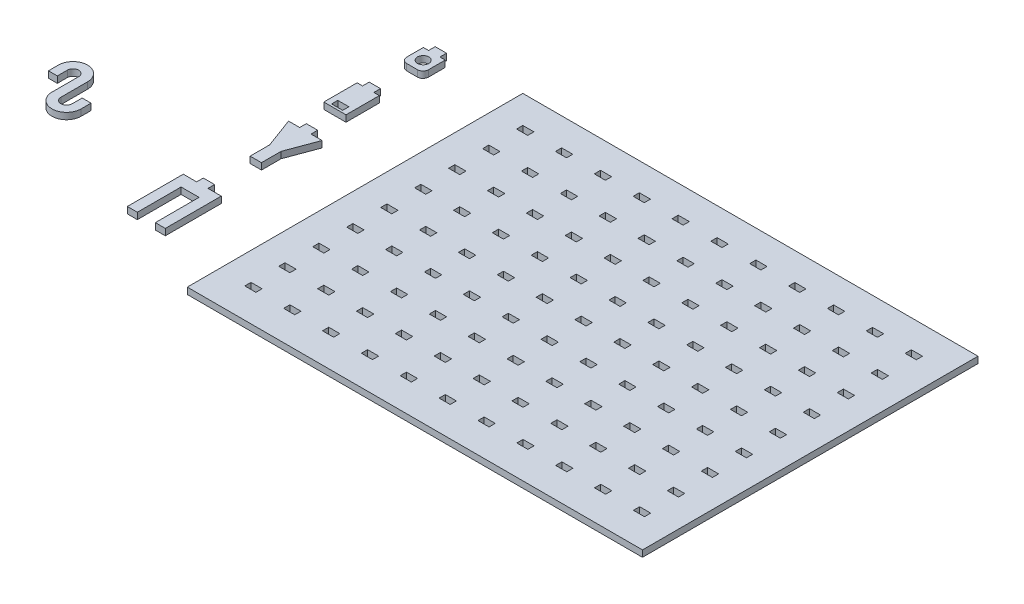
SolidWorks part; units mm, degrees
ref_plane "Front Plane" through (0, 0, 0) normal (0, 0, 1) x (1, 0, 0)
ref_plane "Top Plane" through (0, 0, 0) normal (0, 1, 0) x (1, 0, 0)
ref_plane "Right Plane" through (0, 0, 0) normal (1, 0, 0) x (0, 0, -1)
sketch "Sketch1" plane through (0, 0, 0) normal (0, 1, 0) x (1, 0, 0)
  line L0 (-140, 122.4146) -> (-130, 122.4146)
  line L1 (-200, -154.7854) -> (210, -154.7854)
  line L2 (-200, -154.7854) -> (-200, 147.4146)
  line L3 (-200, 147.4146) -> (210, 147.4146)
  line L4 (210, -154.7854) -> (210, 147.4146)
  line L5 (-175, 116.8146) -> (-165, 116.8146)
  line L6 (-200, 147.4146) -> (210, -154.7854) construction
  line L7 (-175, 116.8146) -> (-175, 122.4146)
  line L8 (-175, 122.4146) -> (-165, 122.4146)
  line L9 (-165, 116.8146) -> (-165, 122.4146)
  line L10 (-175, 116.8146) -> (-165, 122.4146) construction
  line L11 (-175, 122.4146) -> (-165, 116.8146) construction
  line L12 (-140, 116.8146) -> (-140, 122.4146)
  line L13 (-140, 116.8146) -> (-130, 116.8146)
  line L14 (-130, 116.8146) -> (-130, 122.4146)
  line L15 (-105, 122.4146) -> (-95, 122.4146)
  line L16 (-105, 116.8146) -> (-105, 122.4146)
  line L17 (-105, 116.8146) -> (-95, 116.8146)
  line L18 (-95, 116.8146) -> (-95, 122.4146)
  line L19 (-70, 122.4146) -> (-60, 122.4146)
  line L20 (-70, 116.8146) -> (-70, 122.4146)
  line L21 (-70, 116.8146) -> (-60, 116.8146)
  line L22 (-60, 116.8146) -> (-60, 122.4146)
  line L23 (-35, 122.4146) -> (-25, 122.4146)
  line L24 (-35, 116.8146) -> (-35, 122.4146)
  line L25 (-35, 116.8146) -> (-25, 116.8146)
  line L26 (-25, 116.8146) -> (-25, 122.4146)
  line L27 (0, 122.4146) -> (10, 122.4146)
  line L28 (0, 116.8146) -> (0, 122.4146)
  line L29 (0, 116.8146) -> (10, 116.8146)
  line L30 (10, 116.8146) -> (10, 122.4146)
  line L31 (35, 122.4146) -> (45, 122.4146)
  line L32 (35, 116.8146) -> (35, 122.4146)
  line L33 (35, 116.8146) -> (45, 116.8146)
  line L34 (45, 116.8146) -> (45, 122.4146)
  line L35 (70, 122.4146) -> (80, 122.4146)
  line L36 (70, 116.8146) -> (70, 122.4146)
  line L37 (70, 116.8146) -> (80, 116.8146)
  line L38 (80, 116.8146) -> (80, 122.4146)
  line L39 (105, 122.4146) -> (115, 122.4146)
  line L40 (105, 116.8146) -> (105, 122.4146)
  line L41 (105, 116.8146) -> (115, 116.8146)
  line L42 (115, 116.8146) -> (115, 122.4146)
  line L43 (140, 122.4146) -> (150, 122.4146)
  line L44 (140, 116.8146) -> (140, 122.4146)
  line L45 (140, 116.8146) -> (150, 116.8146)
  line L46 (150, 116.8146) -> (150, 122.4146)
  line L47 (175, 122.4146) -> (185, 122.4146)
  line L48 (175, 116.8146) -> (175, 122.4146)
  line L49 (175, 116.8146) -> (185, 116.8146)
  line L50 (185, 116.8146) -> (185, 122.4146)
  line L51 (-270.7628, 160.64) -> (-270.7628, 120.2756) construction
  line L52 (-275.8888, 144.3945) -> (-265.6888, 144.3945)
  line L53 (-275.8888, 144.3945) -> (-275.8888, 138.4445)
  line L54 (-272.877, 95.0581) -> (-272.877, 60.3266) construction
  line L55 (-265.6888, 144.3945) -> (-265.6888, 138.4445)
  line L56 (-275.8888, 144.3945) -> (-265.6888, 138.4445) construction
  line L57 (-270.7628, 141.4043) -> (-265.6888, 144.3945) construction
  line L58 (-275.8888, 138.4445) -> (-280.5889, 138.4445)
  line L59 (-265.9367, 118.4445) -> (-275.5889, 118.4445)
  line L60 (-260.9367, 123.4445) -> (-260.9367, 138.4445)
  line L61 (-260.9367, 138.4445) -> (-265.6888, 138.4445)
  line L62 (-280.5889, 123.4445) -> (-280.5889, 138.4445)
  line L63 (-260.9367, 118.4445) -> (-280.5889, 138.4445) construction
  line L64 (-260.9367, 138.4445) -> (-280.5889, 118.4445) construction
  line L65 (-277.977, 87.0583) -> (-267.777, 87.0583)
  line L66 (-277.977, 87.0583) -> (-277.977, 81.0583)
  line L67 (-140, 91.8146) -> (-130, 91.8146)
  line L68 (-140, 86.2146) -> (-140, 91.8146)
  line L69 (-140, 86.2146) -> (-130, 86.2146)
  line L70 (-130, 86.2146) -> (-130, 91.8146)
  line L71 (-105, 91.8146) -> (-95, 91.8146)
  line L72 (-105, 86.2146) -> (-105, 91.8146)
  line L73 (-105, 86.2146) -> (-95, 86.2146)
  line L74 (-95, 86.2146) -> (-95, 91.8146)
  line L75 (-70, 91.8146) -> (-60, 91.8146)
  line L76 (-70, 86.2146) -> (-70, 91.8146)
  line L77 (-70, 86.2146) -> (-60, 86.2146)
  line L78 (-60, 86.2146) -> (-60, 91.8146)
  line L79 (-35, 91.8146) -> (-25, 91.8146)
  line L80 (-35, 86.2146) -> (-35, 91.8146)
  line L81 (-35, 86.2146) -> (-25, 86.2146)
  line L82 (-25, 86.2146) -> (-25, 91.8146)
  line L83 (0, 91.8146) -> (10, 91.8146)
  line L84 (0, 86.2146) -> (0, 91.8146)
  line L85 (0, 86.2146) -> (10, 86.2146)
  line L86 (10, 86.2146) -> (10, 91.8146)
  line L87 (35, 91.8146) -> (45, 91.8146)
  line L88 (35, 86.2146) -> (35, 91.8146)
  line L89 (35, 86.2146) -> (45, 86.2146)
  line L90 (45, 86.2146) -> (45, 91.8146)
  line L91 (70, 91.8146) -> (80, 91.8146)
  line L92 (70, 86.2146) -> (70, 91.8146)
  line L93 (70, 86.2146) -> (80, 86.2146)
  line L94 (80, 86.2146) -> (80, 91.8146)
  line L95 (105, 91.8146) -> (115, 91.8146)
  line L96 (105, 86.2146) -> (105, 91.8146)
  line L97 (105, 86.2146) -> (115, 86.2146)
  line L98 (115, 86.2146) -> (115, 91.8146)
  line L99 (140, 91.8146) -> (150, 91.8146)
  line L100 (140, 86.2146) -> (140, 91.8146)
  line L101 (140, 86.2146) -> (150, 86.2146)
  line L102 (150, 86.2146) -> (150, 91.8146)
  line L103 (175, 91.8146) -> (185, 91.8146)
  line L104 (175, 86.2146) -> (175, 91.8146)
  line L105 (175, 86.2146) -> (185, 86.2146)
  line L106 (185, 86.2146) -> (185, 91.8146)
  line L107 (-277.877, 58.6716) -> (-267.877, 58.6716)
  line L108 (-267.777, 87.0583) -> (-267.777, 81.0583)
  line L109 (-277.977, 87.0583) -> (-267.777, 81.0583) construction
  line L110 (-277.977, 81.0583) -> (-267.777, 87.0583) construction
  line L111 (-277.977, 81.0583) -> (-282.8724, 81.0583)
  line L112 (-262.8816, 51.0583) -> (-282.8724, 51.0583)
  line L113 (-262.8816, 51.0583) -> (-262.8816, 81.0583)
  line L114 (-262.8816, 81.0583) -> (-267.777, 81.0583)
  line L115 (-282.8724, 51.0583) -> (-282.8724, 81.0583)
  line L116 (-262.8816, 51.0583) -> (-282.8724, 81.0583) construction
  line L117 (-262.8816, 81.0583) -> (-282.8724, 51.0583) construction
  line L118 (-277.877, 53.0716) -> (-277.877, 58.6716)
  line L119 (-277.877, 53.0716) -> (-267.877, 53.0716)
  line L120 (-267.877, 53.0716) -> (-267.877, 58.6716)
  line L121 (-268.7486, -6.567) -> (-268.7486, 42.3773) construction
  line L122 (-272.777, -45.7127) -> (-272.777, -115.1406) construction
  line L123 (-140, 61.2146) -> (-130, 61.2146)
  line L124 (-140, 55.6146) -> (-140, 61.2146)
  line L125 (-140, 55.6146) -> (-130, 55.6146)
  line L126 (-130, 55.6146) -> (-130, 61.2146)
  line L127 (-105, 61.2146) -> (-95, 61.2146)
  line L128 (-105, 55.6146) -> (-105, 61.2146)
  line L129 (-105, 55.6146) -> (-95, 55.6146)
  line L130 (-95, 55.6146) -> (-95, 61.2146)
  line L131 (-70, 61.2146) -> (-60, 61.2146)
  line L132 (-70, 55.6146) -> (-70, 61.2146)
  line L133 (-70, 55.6146) -> (-60, 55.6146)
  line L134 (-60, 55.6146) -> (-60, 61.2146)
  line L135 (-35, 61.2146) -> (-25, 61.2146)
  line L136 (-35, 55.6146) -> (-35, 61.2146)
  line L137 (-35, 55.6146) -> (-25, 55.6146)
  line L138 (-25, 55.6146) -> (-25, 61.2146)
  line L139 (0, 61.2146) -> (10, 61.2146)
  line L140 (0, 55.6146) -> (0, 61.2146)
  line L141 (0, 55.6146) -> (10, 55.6146)
  line L142 (10, 55.6146) -> (10, 61.2146)
  line L143 (35, 61.2146) -> (45, 61.2146)
  line L144 (35, 55.6146) -> (35, 61.2146)
  line L145 (35, 55.6146) -> (45, 55.6146)
  line L146 (45, 55.6146) -> (45, 61.2146)
  line L147 (70, 61.2146) -> (80, 61.2146)
  line L148 (70, 55.6146) -> (70, 61.2146)
  line L149 (70, 55.6146) -> (80, 55.6146)
  line L150 (80, 55.6146) -> (80, 61.2146)
  line L151 (105, 61.2146) -> (115, 61.2146)
  line L152 (105, 55.6146) -> (105, 61.2146)
  line L153 (105, 55.6146) -> (115, 55.6146)
  line L154 (115, 55.6146) -> (115, 61.2146)
  line L155 (140, 61.2146) -> (150, 61.2146)
  line L156 (140, 55.6146) -> (140, 61.2146)
  line L157 (140, 55.6146) -> (150, 55.6146)
  line L158 (150, 55.6146) -> (150, 61.2146)
  line L159 (175, 61.2146) -> (185, 61.2146)
  line L160 (175, 55.6146) -> (175, 61.2146)
  line L161 (175, 55.6146) -> (185, 55.6146)
  line L162 (185, 55.6146) -> (185, 61.2146)
  line L163 (-263.6486, 20.3034) -> (-263.6486, 26.3034)
  line L164 (-263.6486, 26.3034) -> (-273.8486, 26.3034)
  line L165 (-273.8486, 20.3034) -> (-273.8486, 26.3034)
  line L166 (-263.6486, 20.3034) -> (-273.8486, 26.3034) construction
  line L167 (-263.6486, 26.3034) -> (-273.8486, 20.3034) construction
  line L168 (-273.8486, 20.3034) -> (-283.8775, 20.3034)
  line L169 (-283.8775, 20.3034) -> (-273.8486, -6.6879)
  line L170 (-273.8486, -6.6879) -> (-273.8486, -24.3222)
  line L171 (-273.8486, -24.3222) -> (-263.6486, -24.3222)
  line L172 (-263.6486, -24.3222) -> (-263.6486, -6.6879)
  line L173 (-263.6486, -6.6879) -> (-253.6197, 20.3034)
  line L174 (-253.6197, 20.3034) -> (-263.6486, 20.3034)
  line L175 (-418.1294, -17.3103) -> (-418.1294, -147.1066) construction
  line L176 (-267.677, -68.4979) -> (-267.677, -62.4979)
  line L177 (-267.677, -62.4979) -> (-277.877, -62.4979)
  line L178 (-277.877, -68.4979) -> (-277.877, -62.4979)
  line L179 (-140, 30.6146) -> (-130, 30.6146)
  line L180 (-140, 25.0146) -> (-140, 30.6146)
  line L181 (-140, 25.0146) -> (-130, 25.0146)
  line L182 (-130, 25.0146) -> (-130, 30.6146)
  line L183 (-105, 30.6146) -> (-95, 30.6146)
  line L184 (-105, 25.0146) -> (-105, 30.6146)
  line L185 (-105, 25.0146) -> (-95, 25.0146)
  line L186 (-95, 25.0146) -> (-95, 30.6146)
  line L187 (-70, 30.6146) -> (-60, 30.6146)
  line L188 (-70, 25.0146) -> (-70, 30.6146)
  line L189 (-70, 25.0146) -> (-60, 25.0146)
  line L190 (-60, 25.0146) -> (-60, 30.6146)
  line L191 (-35, 30.6146) -> (-25, 30.6146)
  line L192 (-35, 25.0146) -> (-35, 30.6146)
  line L193 (-35, 25.0146) -> (-25, 25.0146)
  line L194 (-25, 25.0146) -> (-25, 30.6146)
  line L195 (0, 30.6146) -> (10, 30.6146)
  line L196 (0, 25.0146) -> (0, 30.6146)
  line L197 (0, 25.0146) -> (10, 25.0146)
  line L198 (10, 25.0146) -> (10, 30.6146)
  line L199 (35, 30.6146) -> (45, 30.6146)
  line L200 (35, 25.0146) -> (35, 30.6146)
  line L201 (35, 25.0146) -> (45, 25.0146)
  line L202 (45, 25.0146) -> (45, 30.6146)
  line L203 (70, 30.6146) -> (80, 30.6146)
  line L204 (70, 25.0146) -> (70, 30.6146)
  line L205 (70, 25.0146) -> (80, 25.0146)
  line L206 (80, 25.0146) -> (80, 30.6146)
  line L207 (105, 30.6146) -> (115, 30.6146)
  line L208 (105, 25.0146) -> (105, 30.6146)
  line L209 (105, 25.0146) -> (115, 25.0146)
  line L210 (115, 25.0146) -> (115, 30.6146)
  line L211 (140, 30.6146) -> (150, 30.6146)
  line L212 (140, 25.0146) -> (140, 30.6146)
  line L213 (140, 25.0146) -> (150, 25.0146)
  line L214 (150, 25.0146) -> (150, 30.6146)
  line L215 (175, 30.6146) -> (185, 30.6146)
  line L216 (175, 25.0146) -> (175, 30.6146)
  line L217 (175, 25.0146) -> (185, 25.0146)
  line L218 (185, 25.0146) -> (185, 30.6146)
  line L219 (-267.677, -68.4979) -> (-277.877, -62.4979) construction
  line L220 (-267.677, -62.4979) -> (-277.877, -68.4979) construction
  line L221 (-277.877, -68.4979) -> (-289.877, -68.4979)
  line L222 (-289.877, -68.4979) -> (-289.877, -118.8935)
  line L223 (-289.877, -118.8935) -> (-280.877, -118.8935)
  line L224 (-280.877, -118.8935) -> (-280.877, -79.4979)
  line L225 (-280.877, -79.4979) -> (-264.677, -79.4979)
  line L226 (-255.677, -118.8935) -> (-264.677, -118.8935)
  line L227 (-264.677, -118.8935) -> (-264.677, -79.4979)
  line L228 (-255.677, -68.4979) -> (-255.677, -118.8935)
  line L229 (-267.677, -68.4979) -> (-255.677, -68.4979)
  line L231 (-413.0294, -39.6105) -> (-413.0294, -63.6105)
  line L233 (-405.0294, -39.6105) -> (-405.0294, -63.6105)
  line L234 (-413.0294, -39.6105) -> (-405.0294, -63.6105) construction
  line L235 (-140, 0.0146) -> (-130, 0.0146)
  line L236 (-140, -5.5854) -> (-140, 0.0146)
  line L237 (-140, -5.5854) -> (-130, -5.5854)
  line L238 (-130, -5.5854) -> (-130, 0.0146)
  line L239 (-105, 0.0146) -> (-95, 0.0146)
  line L240 (-105, -5.5854) -> (-105, 0.0146)
  line L241 (-105, -5.5854) -> (-95, -5.5854)
  line L242 (-95, -5.5854) -> (-95, 0.0146)
  line L243 (-70, 0.0146) -> (-60, 0.0146)
  line L244 (-70, -5.5854) -> (-70, 0.0146)
  line L245 (-70, -5.5854) -> (-60, -5.5854)
  line L246 (-60, -5.5854) -> (-60, 0.0146)
  line L247 (-35, 0.0146) -> (-25, 0.0146)
  line L248 (-35, -5.5854) -> (-35, 0.0146)
  line L249 (-35, -5.5854) -> (-25, -5.5854)
  line L250 (-25, -5.5854) -> (-25, 0.0146)
  line L251 (0, 0.0146) -> (10, 0.0146)
  line L252 (0, -5.5854) -> (0, 0.0146)
  line L253 (0, -5.5854) -> (10, -5.5854)
  line L254 (10, -5.5854) -> (10, 0.0146)
  line L255 (35, 0.0146) -> (45, 0.0146)
  line L256 (35, -5.5854) -> (35, 0.0146)
  line L257 (35, -5.5854) -> (45, -5.5854)
  line L258 (45, -5.5854) -> (45, 0.0146)
  line L259 (70, 0.0146) -> (80, 0.0146)
  line L260 (70, -5.5854) -> (70, 0.0146)
  line L261 (70, -5.5854) -> (80, -5.5854)
  line L262 (80, -5.5854) -> (80, 0.0146)
  line L263 (105, 0.0146) -> (115, 0.0146)
  line L264 (105, -5.5854) -> (105, 0.0146)
  line L265 (105, -5.5854) -> (115, -5.5854)
  line L266 (115, -5.5854) -> (115, 0.0146)
  line L267 (140, 0.0146) -> (150, 0.0146)
  line L268 (140, -5.5854) -> (140, 0.0146)
  line L269 (140, -5.5854) -> (150, -5.5854)
  line L270 (150, -5.5854) -> (150, 0.0146)
  line L271 (175, 0.0146) -> (185, 0.0146)
  line L272 (175, -5.5854) -> (175, 0.0146)
  line L273 (175, -5.5854) -> (185, -5.5854)
  line L274 (185, -5.5854) -> (185, 0.0146)
  line L275 (-413.0294, -63.6105) -> (-405.0294, -39.6105) construction
  line L277 (-409.0294, -51.6105) -> (-497.7476, -51.6105) construction
  line L278 (-423.2294, -48.6105) -> (-431.2294, -48.6105)
  line L279 (-423.2294, -48.6105) -> (-423.2294, -39.6105)
  line L281 (-431.2294, -48.6105) -> (-431.2294, -39.6105)
  line L282 (-423.2294, -48.6105) -> (-431.2294, -39.6105) construction
  line L283 (-427.2294, -44.1105) -> (-431.2294, -48.6105) construction
  line L284 (-409.0294, -67.5686) -> (-409.0294, -109.2605) construction
  line L287 (-394.8294, -63.6105) -> (-394.8294, -54.6105)
  line L288 (-386.8294, -63.6105) -> (-386.8294, -54.6105)
  line L289 (-394.8294, -54.6105) -> (-386.8294, -54.6105)
  line L291 (-140, -30.5854) -> (-130, -30.5854)
  line L292 (-140, -36.1854) -> (-140, -30.5854)
  line L293 (-140, -36.1854) -> (-130, -36.1854)
  line L294 (-130, -36.1854) -> (-130, -30.5854)
  line L295 (-105, -30.5854) -> (-95, -30.5854)
  line L296 (-105, -36.1854) -> (-105, -30.5854)
  line L297 (-105, -36.1854) -> (-95, -36.1854)
  line L298 (-95, -36.1854) -> (-95, -30.5854)
  line L299 (-70, -30.5854) -> (-60, -30.5854)
  line L300 (-70, -36.1854) -> (-70, -30.5854)
  line L301 (-70, -36.1854) -> (-60, -36.1854)
  line L302 (-60, -36.1854) -> (-60, -30.5854)
  line L303 (-35, -30.5854) -> (-25, -30.5854)
  line L304 (-35, -36.1854) -> (-35, -30.5854)
  line L305 (-35, -36.1854) -> (-25, -36.1854)
  line L306 (-25, -36.1854) -> (-25, -30.5854)
  line L307 (0, -30.5854) -> (10, -30.5854)
  line L308 (0, -36.1854) -> (0, -30.5854)
  line L309 (0, -36.1854) -> (10, -36.1854)
  line L310 (10, -36.1854) -> (10, -30.5854)
  line L311 (35, -30.5854) -> (45, -30.5854)
  line L312 (35, -36.1854) -> (35, -30.5854)
  line L313 (35, -36.1854) -> (45, -36.1854)
  line L314 (45, -36.1854) -> (45, -30.5854)
  line L315 (70, -30.5854) -> (80, -30.5854)
  line L316 (70, -36.1854) -> (70, -30.5854)
  line L317 (70, -36.1854) -> (80, -36.1854)
  line L318 (80, -36.1854) -> (80, -30.5854)
  line L319 (105, -30.5854) -> (115, -30.5854)
  line L320 (105, -36.1854) -> (105, -30.5854)
  line L321 (105, -36.1854) -> (115, -36.1854)
  line L322 (115, -36.1854) -> (115, -30.5854)
  line L323 (140, -30.5854) -> (150, -30.5854)
  line L324 (140, -36.1854) -> (140, -30.5854)
  line L325 (140, -36.1854) -> (150, -36.1854)
  line L326 (150, -36.1854) -> (150, -30.5854)
  line L327 (175, -30.5854) -> (185, -30.5854)
  line L328 (175, -36.1854) -> (175, -30.5854)
  line L329 (175, -36.1854) -> (185, -36.1854)
  line L330 (185, -36.1854) -> (185, -30.5854)
  line L347 (-140, -61.1854) -> (-130, -61.1854)
  line L348 (-140, -66.7854) -> (-140, -61.1854)
  line L349 (-140, -66.7854) -> (-130, -66.7854)
  line L350 (-130, -66.7854) -> (-130, -61.1854)
  line L351 (-105, -61.1854) -> (-95, -61.1854)
  line L352 (-105, -66.7854) -> (-105, -61.1854)
  line L353 (-105, -66.7854) -> (-95, -66.7854)
  line L354 (-95, -66.7854) -> (-95, -61.1854)
  line L355 (-70, -61.1854) -> (-60, -61.1854)
  line L356 (-70, -66.7854) -> (-70, -61.1854)
  line L357 (-70, -66.7854) -> (-60, -66.7854)
  line L358 (-60, -66.7854) -> (-60, -61.1854)
  line L359 (-35, -61.1854) -> (-25, -61.1854)
  line L360 (-35, -66.7854) -> (-35, -61.1854)
  line L361 (-35, -66.7854) -> (-25, -66.7854)
  line L362 (-25, -66.7854) -> (-25, -61.1854)
  line L363 (0, -61.1854) -> (10, -61.1854)
  line L364 (0, -66.7854) -> (0, -61.1854)
  line L365 (0, -66.7854) -> (10, -66.7854)
  line L366 (10, -66.7854) -> (10, -61.1854)
  line L367 (35, -61.1854) -> (45, -61.1854)
  line L368 (35, -66.7854) -> (35, -61.1854)
  line L369 (35, -66.7854) -> (45, -66.7854)
  line L370 (45, -66.7854) -> (45, -61.1854)
  line L371 (70, -61.1854) -> (80, -61.1854)
  line L372 (70, -66.7854) -> (70, -61.1854)
  line L373 (70, -66.7854) -> (80, -66.7854)
  line L374 (80, -66.7854) -> (80, -61.1854)
  line L375 (105, -61.1854) -> (115, -61.1854)
  line L376 (105, -66.7854) -> (105, -61.1854)
  line L377 (105, -66.7854) -> (115, -66.7854)
  line L378 (115, -66.7854) -> (115, -61.1854)
  line L379 (140, -61.1854) -> (150, -61.1854)
  line L380 (140, -66.7854) -> (140, -61.1854)
  line L381 (140, -66.7854) -> (150, -66.7854)
  line L382 (150, -66.7854) -> (150, -61.1854)
  line L383 (175, -61.1854) -> (185, -61.1854)
  line L384 (175, -66.7854) -> (175, -61.1854)
  line L385 (175, -66.7854) -> (185, -66.7854)
  line L386 (185, -66.7854) -> (185, -61.1854)
  line L403 (-140, -91.7854) -> (-130, -91.7854)
  line L404 (-140, -97.3854) -> (-140, -91.7854)
  line L405 (-140, -97.3854) -> (-130, -97.3854)
  line L406 (-130, -97.3854) -> (-130, -91.7854)
  line L407 (-105, -91.7854) -> (-95, -91.7854)
  line L408 (-105, -97.3854) -> (-105, -91.7854)
  line L409 (-105, -97.3854) -> (-95, -97.3854)
  line L410 (-95, -97.3854) -> (-95, -91.7854)
  line L411 (-70, -91.7854) -> (-60, -91.7854)
  line L412 (-70, -97.3854) -> (-70, -91.7854)
  line L413 (-70, -97.3854) -> (-60, -97.3854)
  line L414 (-60, -97.3854) -> (-60, -91.7854)
  line L415 (-35, -91.7854) -> (-25, -91.7854)
  line L416 (-35, -97.3854) -> (-35, -91.7854)
  line L417 (-35, -97.3854) -> (-25, -97.3854)
  line L418 (-25, -97.3854) -> (-25, -91.7854)
  line L419 (0, -91.7854) -> (10, -91.7854)
  line L420 (0, -97.3854) -> (0, -91.7854)
  line L421 (0, -97.3854) -> (10, -97.3854)
  line L422 (10, -97.3854) -> (10, -91.7854)
  line L423 (35, -91.7854) -> (45, -91.7854)
  line L424 (35, -97.3854) -> (35, -91.7854)
  line L425 (35, -97.3854) -> (45, -97.3854)
  line L426 (45, -97.3854) -> (45, -91.7854)
  line L427 (70, -91.7854) -> (80, -91.7854)
  line L428 (70, -97.3854) -> (70, -91.7854)
  line L429 (70, -97.3854) -> (80, -97.3854)
  line L430 (80, -97.3854) -> (80, -91.7854)
  line L431 (105, -91.7854) -> (115, -91.7854)
  line L432 (105, -97.3854) -> (105, -91.7854)
  line L433 (105, -97.3854) -> (115, -97.3854)
  line L434 (115, -97.3854) -> (115, -91.7854)
  line L435 (140, -91.7854) -> (150, -91.7854)
  line L436 (140, -97.3854) -> (140, -91.7854)
  line L437 (140, -97.3854) -> (150, -97.3854)
  line L438 (150, -97.3854) -> (150, -91.7854)
  line L439 (175, -91.7854) -> (185, -91.7854)
  line L440 (175, -97.3854) -> (175, -91.7854)
  line L441 (175, -97.3854) -> (185, -97.3854)
  line L442 (185, -97.3854) -> (185, -91.7854)
  line L459 (-140, -122.3854) -> (-130, -122.3854)
  line L460 (-140, -127.9854) -> (-140, -122.3854)
  line L461 (-140, -127.9854) -> (-130, -127.9854)
  line L462 (-130, -127.9854) -> (-130, -122.3854)
  line L463 (-105, -122.3854) -> (-95, -122.3854)
  line L464 (-105, -127.9854) -> (-105, -122.3854)
  line L465 (-105, -127.9854) -> (-95, -127.9854)
  line L466 (-95, -127.9854) -> (-95, -122.3854)
  line L467 (-70, -122.3854) -> (-60, -122.3854)
  line L468 (-70, -127.9854) -> (-70, -122.3854)
  line L469 (-70, -127.9854) -> (-60, -127.9854)
  line L470 (-60, -127.9854) -> (-60, -122.3854)
  line L471 (-35, -122.3854) -> (-25, -122.3854)
  line L472 (-35, -127.9854) -> (-35, -122.3854)
  line L473 (-35, -127.9854) -> (-25, -127.9854)
  line L474 (-25, -127.9854) -> (-25, -122.3854)
  line L475 (0, -122.3854) -> (10, -122.3854)
  line L476 (0, -127.9854) -> (0, -122.3854)
  line L477 (0, -127.9854) -> (10, -127.9854)
  line L478 (10, -127.9854) -> (10, -122.3854)
  line L479 (35, -122.3854) -> (45, -122.3854)
  line L480 (35, -127.9854) -> (35, -122.3854)
  line L481 (35, -127.9854) -> (45, -127.9854)
  line L482 (45, -127.9854) -> (45, -122.3854)
  line L483 (70, -122.3854) -> (80, -122.3854)
  line L484 (70, -127.9854) -> (70, -122.3854)
  line L485 (70, -127.9854) -> (80, -127.9854)
  line L486 (80, -127.9854) -> (80, -122.3854)
  line L487 (105, -122.3854) -> (115, -122.3854)
  line L488 (105, -127.9854) -> (105, -122.3854)
  line L489 (105, -127.9854) -> (115, -127.9854)
  line L490 (115, -127.9854) -> (115, -122.3854)
  line L491 (140, -122.3854) -> (150, -122.3854)
  line L492 (140, -127.9854) -> (140, -122.3854)
  line L493 (140, -127.9854) -> (150, -127.9854)
  line L494 (150, -127.9854) -> (150, -122.3854)
  line L495 (175, -122.3854) -> (185, -122.3854)
  line L496 (175, -127.9854) -> (175, -122.3854)
  line L497 (175, -127.9854) -> (185, -127.9854)
  line L498 (185, -127.9854) -> (185, -122.3854)
  line L627 (-175, 91.8146) -> (-165, 91.8146)
  line L628 (-175, 86.2146) -> (-175, 91.8146)
  line L629 (-175, 86.2146) -> (-165, 86.2146)
  line L630 (-165, 86.2146) -> (-165, 91.8146)
  line L631 (-175, 61.2146) -> (-165, 61.2146)
  line L632 (-175, 55.6146) -> (-175, 61.2146)
  line L633 (-175, 55.6146) -> (-165, 55.6146)
  line L634 (-165, 55.6146) -> (-165, 61.2146)
  line L635 (-175, 30.6146) -> (-165, 30.6146)
  line L636 (-175, 25.0146) -> (-175, 30.6146)
  line L637 (-175, 25.0146) -> (-165, 25.0146)
  line L638 (-165, 25.0146) -> (-165, 30.6146)
  line L639 (-175, 0.0146) -> (-165, 0.0146)
  line L640 (-175, -5.5854) -> (-175, 0.0146)
  line L641 (-175, -5.5854) -> (-165, -5.5854)
  line L642 (-165, -5.5854) -> (-165, 0.0146)
  line L643 (-175, -30.5854) -> (-165, -30.5854)
  line L644 (-175, -36.1854) -> (-175, -30.5854)
  line L645 (-175, -36.1854) -> (-165, -36.1854)
  line L646 (-165, -36.1854) -> (-165, -30.5854)
  line L647 (-175, -61.1854) -> (-165, -61.1854)
  line L648 (-175, -66.7854) -> (-175, -61.1854)
  line L649 (-175, -66.7854) -> (-165, -66.7854)
  line L650 (-165, -66.7854) -> (-165, -61.1854)
  line L651 (-175, -91.7854) -> (-165, -91.7854)
  line L652 (-175, -97.3854) -> (-175, -91.7854)
  line L653 (-175, -97.3854) -> (-165, -97.3854)
  line L654 (-165, -97.3854) -> (-165, -91.7854)
  line L655 (-175, -122.3854) -> (-165, -122.3854)
  line L656 (-175, -127.9854) -> (-175, -122.3854)
  line L657 (-175, -127.9854) -> (-165, -127.9854)
  line L658 (-165, -127.9854) -> (-165, -122.3854)
  line L667 (210, 122.4146) -> (220, 122.4146)
  line L668 (210, 116.8146) -> (220, 116.8146)
  line L669 (220, 116.8146) -> (220, 122.4146)
  line L670 (245, 122.4146) -> (255, 122.4146)
  line L671 (245, 116.8146) -> (245, 122.4146)
  line L672 (245, 116.8146) -> (255, 116.8146)
  line L673 (255, 116.8146) -> (255, 122.4146)
  line L674 (280, 122.4146) -> (290, 122.4146)
  line L675 (280, 116.8146) -> (280, 122.4146)
  line L676 (280, 116.8146) -> (290, 116.8146)
  line L677 (290, 116.8146) -> (290, 122.4146)
  line L678 (315, 122.4146) -> (325, 122.4146)
  line L679 (315, 116.8146) -> (315, 122.4146)
  line L680 (315, 116.8146) -> (325, 116.8146)
  line L681 (325, 116.8146) -> (325, 122.4146)
  line L682 (210, 91.8146) -> (220, 91.8146)
  line L683 (210, 86.2146) -> (220, 86.2146)
  line L684 (220, 86.2146) -> (220, 91.8146)
  line L685 (245, 91.8146) -> (255, 91.8146)
  line L686 (245, 86.2146) -> (245, 91.8146)
  line L687 (245, 86.2146) -> (255, 86.2146)
  line L688 (255, 86.2146) -> (255, 91.8146)
  line L689 (280, 91.8146) -> (290, 91.8146)
  line L690 (280, 86.2146) -> (280, 91.8146)
  line L691 (280, 86.2146) -> (290, 86.2146)
  line L692 (290, 86.2146) -> (290, 91.8146)
  line L693 (315, 91.8146) -> (325, 91.8146)
  line L694 (315, 86.2146) -> (315, 91.8146)
  line L695 (315, 86.2146) -> (325, 86.2146)
  line L696 (325, 86.2146) -> (325, 91.8146)
  line L697 (210, 61.2146) -> (220, 61.2146)
  line L698 (210, 55.6146) -> (220, 55.6146)
  line L699 (220, 55.6146) -> (220, 61.2146)
  line L700 (245, 61.2146) -> (255, 61.2146)
  line L701 (245, 55.6146) -> (245, 61.2146)
  line L702 (245, 55.6146) -> (255, 55.6146)
  line L703 (255, 55.6146) -> (255, 61.2146)
  line L704 (280, 61.2146) -> (290, 61.2146)
  line L705 (280, 55.6146) -> (280, 61.2146)
  line L706 (280, 55.6146) -> (290, 55.6146)
  line L707 (290, 55.6146) -> (290, 61.2146)
  line L708 (315, 61.2146) -> (325, 61.2146)
  line L709 (315, 55.6146) -> (315, 61.2146)
  line L710 (315, 55.6146) -> (325, 55.6146)
  line L711 (325, 55.6146) -> (325, 61.2146)
  line L712 (210, 30.6146) -> (220, 30.6146)
  line L713 (210, 25.0146) -> (220, 25.0146)
  line L714 (220, 25.0146) -> (220, 30.6146)
  line L715 (245, 30.6146) -> (255, 30.6146)
  line L716 (245, 25.0146) -> (245, 30.6146)
  line L717 (245, 25.0146) -> (255, 25.0146)
  line L718 (255, 25.0146) -> (255, 30.6146)
  line L719 (280, 30.6146) -> (290, 30.6146)
  line L720 (280, 25.0146) -> (280, 30.6146)
  line L721 (280, 25.0146) -> (290, 25.0146)
  line L722 (290, 25.0146) -> (290, 30.6146)
  line L723 (315, 30.6146) -> (325, 30.6146)
  line L724 (315, 25.0146) -> (315, 30.6146)
  line L725 (315, 25.0146) -> (325, 25.0146)
  line L726 (325, 25.0146) -> (325, 30.6146)
  line L727 (210, 0.0146) -> (220, 0.0146)
  line L728 (210, -5.5854) -> (220, -5.5854)
  line L729 (220, -5.5854) -> (220, 0.0146)
  line L730 (245, 0.0146) -> (255, 0.0146)
  line L731 (245, -5.5854) -> (245, 0.0146)
  line L732 (245, -5.5854) -> (255, -5.5854)
  line L733 (255, -5.5854) -> (255, 0.0146)
  line L734 (280, 0.0146) -> (290, 0.0146)
  line L735 (280, -5.5854) -> (280, 0.0146)
  line L736 (280, -5.5854) -> (290, -5.5854)
  line L737 (290, -5.5854) -> (290, 0.0146)
  line L738 (315, 0.0146) -> (325, 0.0146)
  line L739 (315, -5.5854) -> (315, 0.0146)
  line L740 (315, -5.5854) -> (325, -5.5854)
  line L741 (325, -5.5854) -> (325, 0.0146)
  line L742 (210, -30.5854) -> (220, -30.5854)
  line L743 (210, -36.1854) -> (220, -36.1854)
  line L744 (220, -36.1854) -> (220, -30.5854)
  line L745 (245, -30.5854) -> (255, -30.5854)
  line L746 (245, -36.1854) -> (245, -30.5854)
  line L747 (245, -36.1854) -> (255, -36.1854)
  line L748 (255, -36.1854) -> (255, -30.5854)
  line L749 (280, -30.5854) -> (290, -30.5854)
  line L750 (280, -36.1854) -> (280, -30.5854)
  line L751 (280, -36.1854) -> (290, -36.1854)
  line L752 (290, -36.1854) -> (290, -30.5854)
  line L753 (315, -30.5854) -> (325, -30.5854)
  line L754 (315, -36.1854) -> (315, -30.5854)
  line L755 (315, -36.1854) -> (325, -36.1854)
  line L756 (325, -36.1854) -> (325, -30.5854)
  line L757 (210, -61.1854) -> (220, -61.1854)
  line L758 (210, -66.7854) -> (220, -66.7854)
  line L759 (220, -66.7854) -> (220, -61.1854)
  line L760 (245, -61.1854) -> (255, -61.1854)
  line L761 (245, -66.7854) -> (245, -61.1854)
  line L762 (245, -66.7854) -> (255, -66.7854)
  line L763 (255, -66.7854) -> (255, -61.1854)
  line L764 (280, -61.1854) -> (290, -61.1854)
  line L765 (280, -66.7854) -> (280, -61.1854)
  line L766 (280, -66.7854) -> (290, -66.7854)
  line L767 (290, -66.7854) -> (290, -61.1854)
  line L768 (315, -61.1854) -> (325, -61.1854)
  line L769 (315, -66.7854) -> (315, -61.1854)
  line L770 (315, -66.7854) -> (325, -66.7854)
  line L771 (325, -66.7854) -> (325, -61.1854)
  line L772 (210, -91.7854) -> (220, -91.7854)
  line L773 (210, -97.3854) -> (220, -97.3854)
  line L774 (220, -97.3854) -> (220, -91.7854)
  line L775 (245, -91.7854) -> (255, -91.7854)
  line L776 (245, -97.3854) -> (245, -91.7854)
  line L777 (245, -97.3854) -> (255, -97.3854)
  line L778 (255, -97.3854) -> (255, -91.7854)
  line L779 (280, -91.7854) -> (290, -91.7854)
  line L780 (280, -97.3854) -> (280, -91.7854)
  line L781 (280, -97.3854) -> (290, -97.3854)
  line L782 (290, -97.3854) -> (290, -91.7854)
  line L783 (315, -91.7854) -> (325, -91.7854)
  line L784 (315, -97.3854) -> (315, -91.7854)
  line L785 (315, -97.3854) -> (325, -97.3854)
  line L786 (325, -97.3854) -> (325, -91.7854)
  line L787 (210, -122.3854) -> (220, -122.3854)
  line L788 (210, -127.9854) -> (220, -127.9854)
  line L789 (220, -127.9854) -> (220, -122.3854)
  line L790 (245, -122.3854) -> (255, -122.3854)
  line L791 (245, -127.9854) -> (245, -122.3854)
  line L792 (245, -127.9854) -> (255, -127.9854)
  line L793 (255, -127.9854) -> (255, -122.3854)
  line L794 (280, -122.3854) -> (290, -122.3854)
  line L795 (280, -127.9854) -> (280, -122.3854)
  line L796 (280, -127.9854) -> (290, -127.9854)
  line L797 (290, -127.9854) -> (290, -122.3854)
  line L798 (315, -122.3854) -> (325, -122.3854)
  line L799 (315, -127.9854) -> (315, -122.3854)
  line L800 (315, -127.9854) -> (325, -127.9854)
  line L801 (325, -127.9854) -> (325, -122.3854)
  line L802 (210, -152.9854) -> (220, -152.9854)
  line L803 (210, -158.5854) -> (220, -158.5854)
  line L804 (220, -158.5854) -> (220, -152.9854)
  line L805 (245, -152.9854) -> (255, -152.9854)
  line L806 (245, -158.5854) -> (245, -152.9854)
  line L807 (245, -158.5854) -> (255, -158.5854)
  line L808 (255, -158.5854) -> (255, -152.9854)
  line L809 (280, -152.9854) -> (290, -152.9854)
  line L810 (280, -158.5854) -> (280, -152.9854)
  line L811 (280, -158.5854) -> (290, -158.5854)
  line L812 (290, -158.5854) -> (290, -152.9854)
  line L813 (315, -152.9854) -> (325, -152.9854)
  line L814 (315, -158.5854) -> (315, -152.9854)
  line L815 (315, -158.5854) -> (325, -158.5854)
  line L816 (325, -158.5854) -> (325, -152.9854)
  line L817 (210, -183.5854) -> (220, -183.5854)
  line L818 (210, -189.1854) -> (220, -189.1854)
  line L819 (220, -189.1854) -> (220, -183.5854)
  line L820 (245, -183.5854) -> (255, -183.5854)
  line L821 (245, -189.1854) -> (245, -183.5854)
  line L822 (245, -189.1854) -> (255, -189.1854)
  line L823 (255, -189.1854) -> (255, -183.5854)
  line L824 (280, -183.5854) -> (290, -183.5854)
  line L825 (280, -189.1854) -> (280, -183.5854)
  line L826 (280, -189.1854) -> (290, -189.1854)
  line L827 (290, -189.1854) -> (290, -183.5854)
  line L828 (315, -183.5854) -> (325, -183.5854)
  line L829 (315, -189.1854) -> (315, -183.5854)
  line L830 (315, -189.1854) -> (325, -189.1854)
  line L831 (325, -189.1854) -> (325, -183.5854)
  line L832 (-140, -183.5854) -> (-130, -183.5854)
  line L833 (-140, -189.1854) -> (-140, -183.5854)
  line L834 (-140, -189.1854) -> (-130, -189.1854)
  line L835 (-130, -189.1854) -> (-130, -183.5854)
  line L836 (-105, -183.5854) -> (-95, -183.5854)
  line L837 (-105, -189.1854) -> (-105, -183.5854)
  line L838 (-105, -189.1854) -> (-95, -189.1854)
  line L839 (-95, -189.1854) -> (-95, -183.5854)
  line L840 (-70, -183.5854) -> (-60, -183.5854)
  line L841 (-70, -189.1854) -> (-70, -183.5854)
  line L842 (-70, -189.1854) -> (-60, -189.1854)
  line L843 (-60, -189.1854) -> (-60, -183.5854)
  line L844 (-35, -183.5854) -> (-25, -183.5854)
  line L845 (-35, -189.1854) -> (-35, -183.5854)
  line L846 (-35, -189.1854) -> (-25, -189.1854)
  line L847 (-25, -189.1854) -> (-25, -183.5854)
  line L848 (0, -183.5854) -> (10, -183.5854)
  line L849 (0, -189.1854) -> (0, -183.5854)
  line L850 (0, -189.1854) -> (10, -189.1854)
  line L851 (10, -189.1854) -> (10, -183.5854)
  line L852 (35, -183.5854) -> (45, -183.5854)
  line L853 (35, -189.1854) -> (35, -183.5854)
  line L854 (35, -189.1854) -> (45, -189.1854)
  line L855 (45, -189.1854) -> (45, -183.5854)
  line L856 (70, -183.5854) -> (80, -183.5854)
  line L857 (70, -189.1854) -> (70, -183.5854)
  line L858 (70, -189.1854) -> (80, -189.1854)
  line L859 (80, -189.1854) -> (80, -183.5854)
  line L860 (105, -183.5854) -> (115, -183.5854)
  line L861 (105, -189.1854) -> (105, -183.5854)
  line L862 (105, -189.1854) -> (115, -189.1854)
  line L863 (115, -189.1854) -> (115, -183.5854)
  line L864 (140, -183.5854) -> (150, -183.5854)
  line L865 (140, -189.1854) -> (140, -183.5854)
  line L866 (140, -189.1854) -> (150, -189.1854)
  line L867 (150, -189.1854) -> (150, -183.5854)
  line L868 (175, -183.5854) -> (185, -183.5854)
  line L869 (175, -189.1854) -> (175, -183.5854)
  line L870 (175, -189.1854) -> (185, -189.1854)
  line L871 (185, -189.1854) -> (185, -183.5854)
  line L872 (210, -189.1854) -> (210, -183.5854)
  line L873 (-175, -183.5854) -> (-165, -183.5854)
  line L874 (-175, -189.1854) -> (-175, -183.5854)
  line L875 (-175, -189.1854) -> (-165, -189.1854)
  line L876 (-165, -189.1854) -> (-165, -183.5854)
  line L877 (-140, -152.9854) -> (-130, -152.9854)
  line L878 (-140, -158.5854) -> (-140, -152.9854)
  line L879 (-140, -158.5854) -> (-130, -158.5854)
  line L880 (-130, -158.5854) -> (-130, -152.9854)
  line L881 (-105, -152.9854) -> (-95, -152.9854)
  line L882 (-105, -158.5854) -> (-105, -152.9854)
  line L883 (-105, -158.5854) -> (-95, -158.5854)
  line L884 (-95, -158.5854) -> (-95, -152.9854)
  line L885 (-70, -152.9854) -> (-60, -152.9854)
  line L886 (-70, -158.5854) -> (-70, -152.9854)
  line L887 (-70, -158.5854) -> (-60, -158.5854)
  line L888 (-60, -158.5854) -> (-60, -152.9854)
  line L889 (-35, -152.9854) -> (-25, -152.9854)
  line L890 (-35, -158.5854) -> (-35, -152.9854)
  line L891 (-35, -158.5854) -> (-25, -158.5854)
  line L892 (-25, -158.5854) -> (-25, -152.9854)
  line L893 (0, -152.9854) -> (10, -152.9854)
  line L894 (0, -158.5854) -> (0, -152.9854)
  line L895 (0, -158.5854) -> (10, -158.5854)
  line L896 (10, -158.5854) -> (10, -152.9854)
  line L897 (35, -152.9854) -> (45, -152.9854)
  line L898 (35, -158.5854) -> (35, -152.9854)
  line L899 (35, -158.5854) -> (45, -158.5854)
  line L900 (45, -158.5854) -> (45, -152.9854)
  line L901 (70, -152.9854) -> (80, -152.9854)
  line L902 (70, -158.5854) -> (70, -152.9854)
  line L903 (70, -158.5854) -> (80, -158.5854)
  line L904 (80, -158.5854) -> (80, -152.9854)
  line L905 (105, -152.9854) -> (115, -152.9854)
  line L906 (105, -158.5854) -> (105, -152.9854)
  line L907 (105, -158.5854) -> (115, -158.5854)
  line L908 (115, -158.5854) -> (115, -152.9854)
  line L909 (140, -152.9854) -> (150, -152.9854)
  line L910 (140, -158.5854) -> (140, -152.9854)
  line L911 (140, -158.5854) -> (150, -158.5854)
  line L912 (150, -158.5854) -> (150, -152.9854)
  line L913 (175, -152.9854) -> (185, -152.9854)
  line L914 (175, -158.5854) -> (175, -152.9854)
  line L915 (175, -158.5854) -> (185, -158.5854)
  line L916 (185, -158.5854) -> (185, -152.9854)
  line L917 (210, -158.5854) -> (210, -152.9854)
  line L918 (-175, -152.9854) -> (-165, -152.9854)
  line L919 (-175, -158.5854) -> (-175, -152.9854)
  line L920 (-175, -158.5854) -> (-165, -158.5854)
  line L921 (-165, -158.5854) -> (-165, -152.9854)
  line L922 (210, 116.8146) -> (210, 122.4146)
  line L923 (210, 86.2146) -> (210, 91.8146)
  line L924 (210, 55.6146) -> (210, 61.2146)
  line L925 (210, 25.0146) -> (210, 30.6146)
  line L926 (210, -5.5854) -> (210, 0.0146)
  line L927 (210, -36.1854) -> (210, -30.5854)
  line L928 (210, -66.7854) -> (210, -61.1854)
  line L929 (210, -97.3854) -> (210, -91.7854)
  line L930 (210, -127.9854) -> (210, -122.3854)
  arc A0 (-265.9367, 118.4445) -> (-260.9367, 123.4445) centre (-265.9367, 123.4445) ccw
  arc A1 (-275.5889, 118.4445) -> (-280.5889, 123.4445) centre (-275.5889, 123.4445) cw
  circle A2 centre (-270.7628, 128.4445) radius 5.126
  arc A3 (-413.0294, -39.6105) -> (-423.2294, -39.6105) centre (-418.1294, -39.6105) ccw
  arc A4 (-405.0294, -39.6105) -> (-431.2294, -39.6105) centre (-418.1294, -39.6105) ccw
  arc A5 (-394.8294, -63.6105) -> (-405.0294, -63.6105) centre (-399.9294, -63.6105) cw
  arc A6 (-386.8294, -63.6105) -> (-413.0294, -63.6105) centre (-399.9294, -63.6105) cw
  point P0 (0, 0)
  point P6 (-170, 119.6146)
  point P12 (-270.7628, 141.4043)
  point P58 (-270.7628, 128.4445)
  point P112 (-272.877, 84.0583)
  point P119 (-272.877, 66.0583)
  point P124 (-268.7486, 23.3034)
  point P221 (-272.777, -65.4979)
  point P234 (-272.777, -79.4979)
  point P277 (-409.0294, -51.6105)
  point P288 (-427.2294, -44.1105)
extrude "Boss-Extrude5" add sketch "Sketch1" along normal blind 5.8
equation "\"kerf\"= 0.1mm"
equation "\"wood-thickness\"= 5.80mm"
equation "\"holes-spacing\"= 25mm"
equation "\"board-height\"= ( \"holes-spacing\" + \"wood-thickness\" ) * 9 + \"holes-spacing\""
equation "\"board-lenght\"= ( \"holes-spacing\" + \"holes-thickness\" ) * 11 + \"holes-spacing\""
equation "\"D2@Sketch1\"=\"board-height\""
equation "\"D1@Sketch1\"=\"board-lenght\""
equation "\"D3@Sketch1\"=\"female-height\""
equation "\"holes-thickness\"= 10mm"
equation "\"D4@Sketch1\"=\"holes-thickness\""
equation "\"D5@Sketch1\"=\"holes-spacing\""
equation "\"D6@Sketch1\"=\"holes-spacing\""
equation "\"D9@Sketch1\"=\"holes-spacing\""
equation "\"D10@Sketch1\"=\"holes-spacing\""
equation "\"female-height\"= \"wood-thickness\" - ( \"kerf\" * 2 )"
equation "\"female-width\"= \"holes-thickness\" - ( \"kerf\" * 2 )"
equation "\"male-width\"= \"holes-thickness\" + ( \"kerf\" * 2 )"
equation "\"male-in\"= \"wood-thickness\" + ( \"kerf\" * 2 )"
equation "\"D1@Boss-Extrude5\"=\"wood-thickness\""
equation "\"D11@Sketch1\"=\"male-width\""
equation "\"D17@Sketch1\"=\"male-width\""
equation "\"D16@Sketch1\"=\"male-in\""
equation "\"D18@Sketch1\"=\"male-in\"*5"
equation "\"D19@Sketch1\"=\"male-width\""
equation "\"D20@Sketch1\"=\"male-in\""
equation "\"D21@Sketch1\"=\"male-in\"*2"
equation "\"D22@Sketch1\"=\"male-in\"*1.5"
equation "\"D23@Sketch1\"=\"male-in\""
equation "\"D27@Sketch1\"=\"male-in\"*1.5"
equation "\"D29@Sketch1\"=\"male-width\""
equation "\"D30@Sketch1\"=\"male-width\""
equation "\"D31@Sketch1\"=\"male-in\"*1.5"
